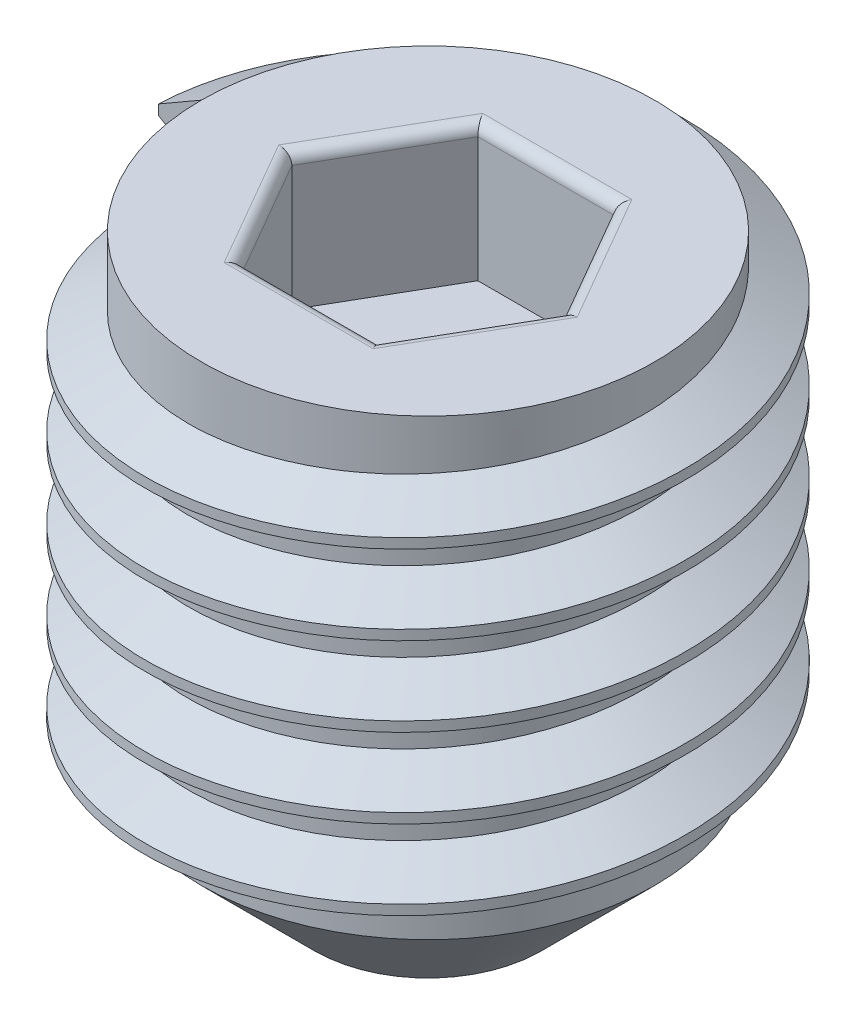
SolidWorks part; units mm, degrees
ref_plane "Front Plane" through (0, 0, 0) normal (0, 0, 1) x (1, 0, 0)
ref_plane "Top Plane" through (0, 0, 0) normal (0, 1, 0) x (1, 0, 0)
ref_plane "Right Plane" through (0, 0, 0) normal (1, 0, 0) x (0, 0, -1)
sketch "Sketch1" plane through (0, 0, 0) normal (0, 1, 0) x (1, 0, 0)
  circle A0 centre (0, 0) radius 2
  dimension "D1" = 4
extrude "Boss-Extrude1" add sketch "Sketch1" along normal blind 5
chamfer "Chamfer1" distance 1 angle 45 1 edges at (0, 0, 2)
thread "Thread1" pitch 0.7 start angle 0, offset 0, length 3.5, pitch 0.7, diameter 4
ref_plane "Plane1" through (-2, 5, 0) normal (0, 0, 1) x (-1, 0, 0)
sketch "Thread Profile1" plane through (-2, 5, 0) normal (0, 0, 1) x (-1, 0, 0)
  line L0 (0, 0) -> (0, 0.7) construction
  line L1 (0, 0) -> (0.3789, 0.2187)
  line L2 (0.3789, 0.2187) -> (0.3789, 0.3062)
  line L3 (0.3789, 0.3062) -> (0, 0.525)
  line L4 (0.3789, 0.2625) -> (0, 0.2625) construction
  line L11 (0, 0) -> (0, 0.525)
  point P2 (0, 0)
  dimension "Pitch" = 0.7
  dimension "Profile_Angle" = 60
  dimension "Profile_Land" = 0.0875
  dimension "Profile_Height" = 0.3789
sketch "Sketch6" plane through (0, 5, 0) normal (0, 1, 0) x (1, 0, 0)
  line L1 (0.6004, 1.04) -> (-0.6004, 1.04)
  line L2 (-0.6004, 1.04) -> (-1.2009, 0)
  line L3 (-1.2009, 0) -> (-0.6004, -1.04)
  line L4 (-0.6004, -1.04) -> (0.6004, -1.04)
  line L5 (0.6004, -1.04) -> (1.2009, 0)
  line L6 (1.2009, 0) -> (0.6004, 1.04)
  circle A0 centre (0, 0) radius 1.04 construction
  dimension "D1" = 2.08
extrude "Cut-Extrude1" cut sketch "Sketch6" against normal blind 1.2
fillet "Fillet1" radius 0.1 6 edges at (0, 5, 1.04) (-0.9007, 5, 0.52) (-0.9007, 5, -0.52) (0, 5, -1.04) (0.9007, 5, -0.52) (0.9007, 5, 0.52)
